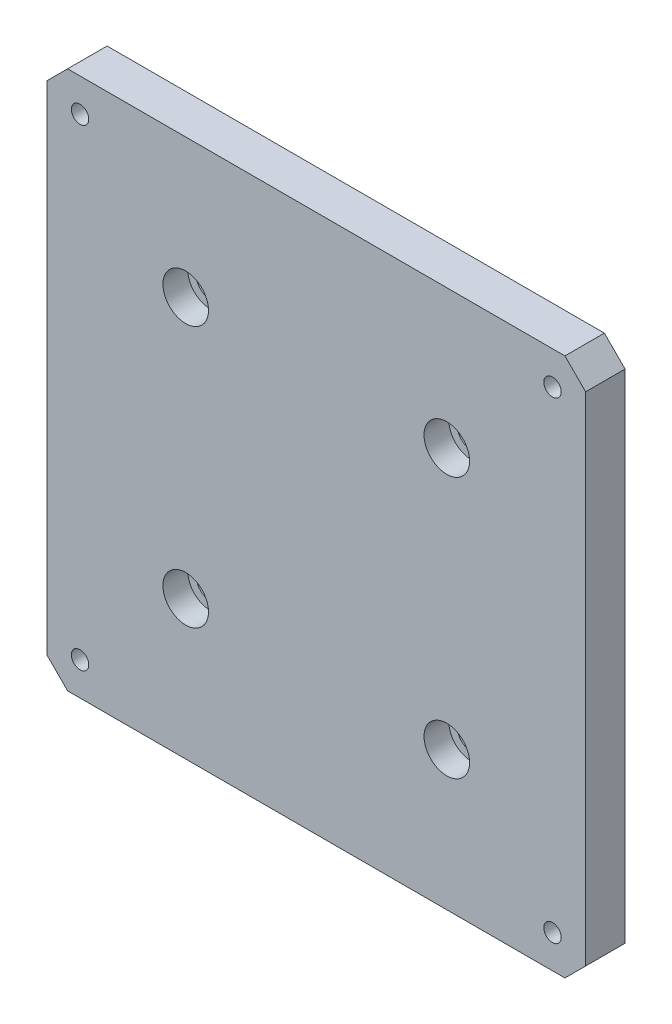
SolidWorks part; units mm, degrees
ref_plane "Front" through (0, 0, 0) normal (0, 0, 1) x (1, 0, 0)
ref_plane "Top" through (0, 0, 0) normal (0, 1, 0) x (1, 0, 0)
ref_plane "Right" through (0, 0, 0) normal (1, 0, 0) x (0, 0, -1)
sketch "Sketch1" plane through (0, 0, 0) normal (0, 0, 1) x (1, 0, 0)
  line L1 (57, -57) -> (-57, -57) construction
  line L2 (57, -57) -> (57, 57) construction
  line L3 (57, 57) -> (-57, 57) construction
  line L4 (-57, -57) -> (-57, 57) construction
  line L5 (0, 57) -> (0, -57) construction
  line L6 (57, 0) -> (-57, 0) construction
  line L7 (65, -65) -> (-65, -65) construction
  line L8 (65, -65) -> (65, 65) construction
  line L9 (65, 65) -> (-65, 65) construction
  line L10 (-65, -65) -> (-65, 65) construction
  line L11 (0, 65) -> (0, -65) construction
  line L12 (65, 0) -> (-65, 0) construction
  line L13 (12.5, -12.5) -> (-12.5, -12.5) construction
  line L14 (12.5, -12.5) -> (12.5, 12.5) construction
  line L15 (12.5, 12.5) -> (-12.5, 12.5) construction
  line L16 (-12.5, -12.5) -> (-12.5, 12.5) construction
  line L17 (12.5, -12.5) -> (-12.5, 12.5) construction
  line L18 (12.5, 12.5) -> (-12.5, -12.5) construction
  point P0 (0, 0)
  point P4 (0, 0)
  point P8 (0, 0)
  dimension "D1" = 25
  dimension "Mjolnir Mounting Holes" = 114
  dimension "Mjolnir Base" = 130
sketch "Sketch7" plane through (0, 0, 0) normal (0, 0, 1) x (1, 0, 0)
  line L7 (31.5, -31.5) -> (-31.5, -31.5) construction
  line L12 (31.5, -31.5) -> (31.5, 31.5) construction
  line L14 (31.5, 31.5) -> (-31.5, 31.5) construction
  line L15 (-31.5, -31.5) -> (-31.5, 31.5) construction
  line L16 (31.5, -31.5) -> (-31.5, 31.5) construction
  line L17 (31.5, 31.5) -> (-31.5, -31.5) construction
  point P0 (0, 0)
  dimension "D1" = 63
sketch "Sketch2" plane through (0, 0, 0) normal (0, 0, 1) x (1, 0, 0)
  line L0 (65, -65) -> (65, 65) construction
  line L1 (65, -65) -> (-65, -65) construction
  line L2 (-65, -65) -> (-65, 65) construction
  line L3 (65, 65) -> (-65, 65) construction
  line L4 (65, -65) -> (65, 65)
  line L5 (65, -65) -> (-65, -65)
  line L6 (-65, -65) -> (-65, 65)
  line L7 (65, 65) -> (-65, 65)
extrude "Boss-Extrude1" add sketch "Sketch2" along normal mid plane 9.525
chamfer "Chamfer1" distance 5 angle 45 4 edges at (-65, 65, 0) (65, 65, 0) (65, -65, 0) (-65, -65, 0)
hole_wizard "Tap Drill for M5x0.8 Tap1" positions "Sketch3" profile "Sketch4" hole size "M5x0.8" standard "ANSI Metric"
sketch "Sketch3" plane through (0, 0, 4.7625) normal (0, 0, 1) x (1, 0, 0)
  point P0 (-57, 57)
  point P3 (57, 57)
  point P6 (-57, -57)
  point P9 (57, -57)
sketch "Sketch4" plane through (-57, 57, 4.7625) normal (1, 0, 0) x (0, -1, 0)
  line L0 (0, 0) -> (0, 9.525)
  line L1 (0, 9.525) -> (2.1, 9.525)
  line L2 (2.1, 9.525) -> (2.1, 0)
  line L5 (2.1, 0) -> (0, 0)
  line L11 (0, -6.35) -> (0, 107.95) construction
  dimension "Thru Hole Dia." = 4.2
  dimension "Thru Hole Depth" = 9.525
hole_wizard "CBORE for M6 SHCS1" positions "Sketch5" profile "Sketch6" counterbore size "M6" standard "ANSI Metric"
sketch "Sketch5" plane through (0, 0, 4.7625) normal (0, 0, 1) x (1, 0, 0)
  point P30 (-31.5, 31.5)
  point P33 (31.5, 31.5)
  point P36 (31.5, -31.5)
  point P39 (-31.5, -31.5)
sketch "Sketch6" plane through (-31.5, 31.5, 4.7625) normal (1, 0, 0) x (0, -1, 0)
  line L0 (0, 0) -> (0, 9.525)
  line L1 (0, 9.525) -> (3.5, 9.525)
  line L3 (3.5, 9.525) -> (3.5, 6)
  line L4 (3.5, 6) -> (5.5, 6)
  line L5 (5.5, 6) -> (5.5, 0)
  line L7 (5.5, 0) -> (0, 0)
  line L11 (0, -6.35) -> (0, 107.95) construction
  dimension "Thru Hole Dia." = 7
  dimension "Thru Hole Depth" = 9.525
  dimension "C'Bore Dia." = 11
  dimension "C'Bore Depth" = 6
